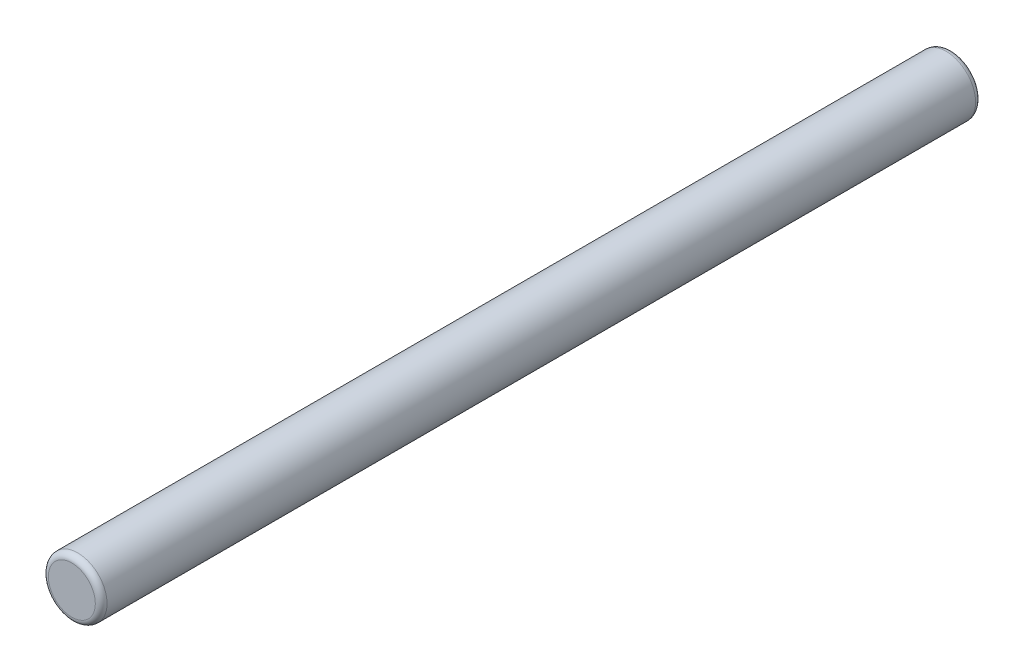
SolidWorks part; units mm, degrees
ref_plane "Face" through (0, 0, 0) normal (0, 0, 1) x (1, 0, 0)
ref_plane "Dessus" through (0, 0, 0) normal (0, 1, 0) x (1, 0, 0)
ref_plane "Droite" through (0, 0, 0) normal (1, 0, 0) x (0, 0, -1)
sketch "Esquisse1" plane through (0, 0, 0) normal (0, 0, 1) x (1, 0, 0)
  circle A0 centre (0, 0) radius 1
  dimension "D1" = 2
extrude "Extrusion1" add sketch "Esquisse1" along normal blind 30
fillet "Congé1" radius 0.2
